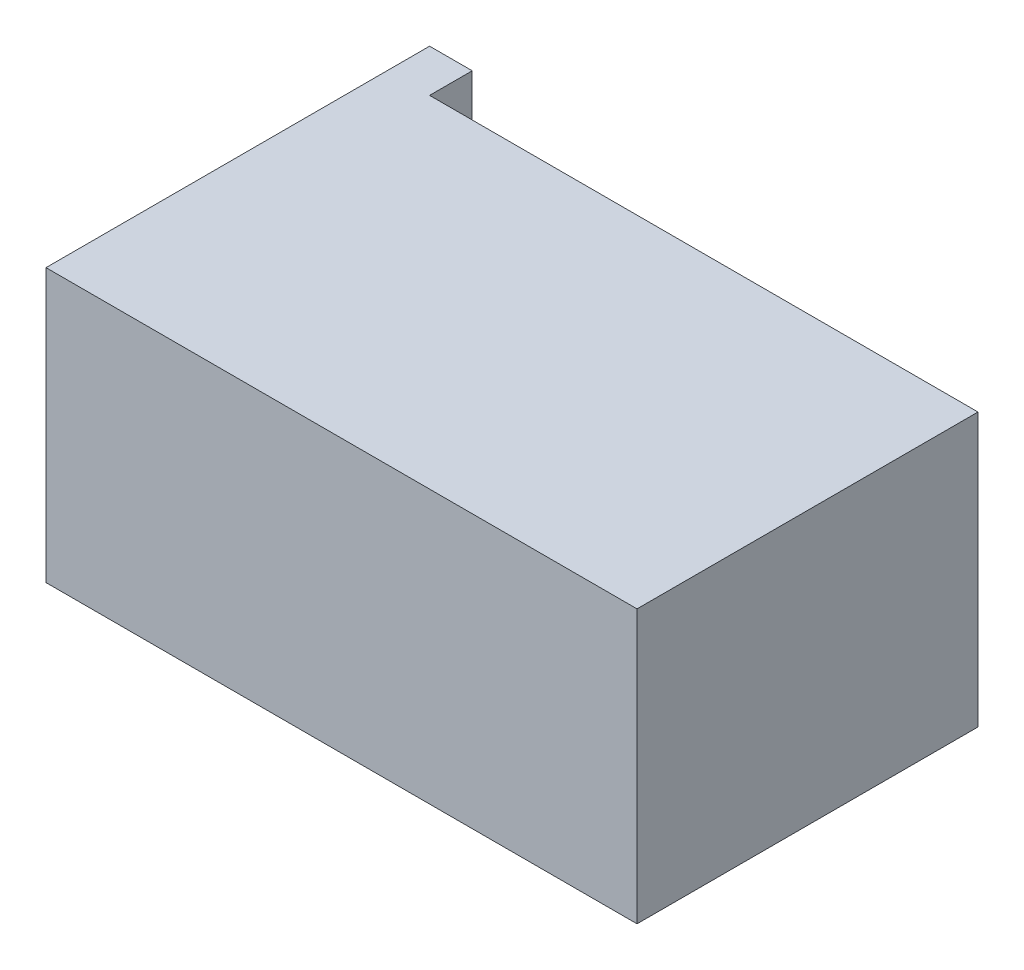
SolidWorks part; units mm, degrees
ref_plane "Front Plane" through (0, 0, 0) normal (0, 0, 1) x (1, 0, 0)
ref_plane "Top Plane" through (0, 0, 0) normal (0, 1, 0) x (1, 0, 0)
ref_plane "Right Plane" through (0, 0, 0) normal (1, 0, 0) x (0, 0, -1)
sketch "Sketch1" plane through (0, 0, 0) normal (0, 1, 0) x (1, 0, 0)
  line L1 (0, 0) -> (52, 0)
  line L2 (0, 0) -> (0, 30)
  line L3 (0, 30) -> (52, 30)
  line L4 (52, 0) -> (52, 30)
  dimension "D1" = 52
  dimension "D2" = 30
extrude "Boss-Extrude1" add sketch "Sketch1" along normal blind 24
sketch "Sketch4" plane through (0, 0, -30) normal (0, 0, -1) x (-1, 0, 0)
  line L0 (-52, 24) -> (0, 24) construction
  line L1 (-3.75, 24) -> (0, 24)
  line L2 (-3.75, 24) -> (-3.75, 0)
  line L3 (-3.75, 0) -> (0, 0)
  line L4 (0, 24) -> (0, 0)
  dimension "D1" = 3.75
extrude "Boss-Extrude2" add sketch "Sketch4" along normal blind 3.75
